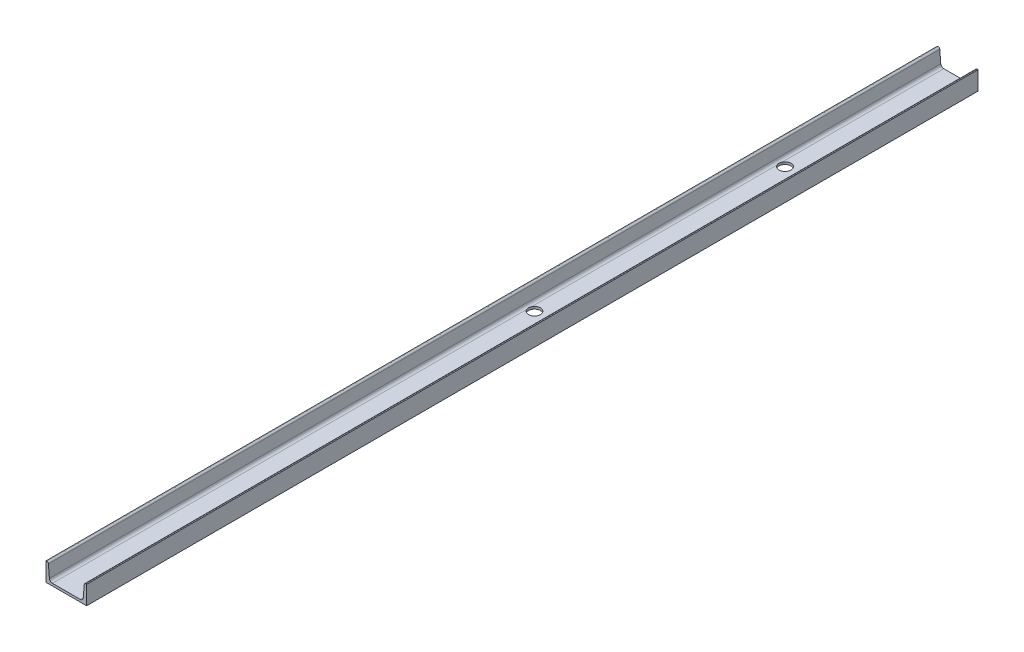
SolidWorks part; units mm, degrees
ref_plane "Plan de face" through (0, 0, 0) normal (0, 0, 1) x (1, 0, 0)
ref_plane "Plan de dessus" through (0, 0, 0) normal (0, 1, 0) x (1, 0, 0)
ref_plane "Plan de droite" through (0, 0, 0) normal (1, 0, 0) x (0, 0, -1)
mirrored part "Rail Intérieur_Symétrique"
other "<Rail Intérieur>-<Enlèv. mat.-Extru.1>"
